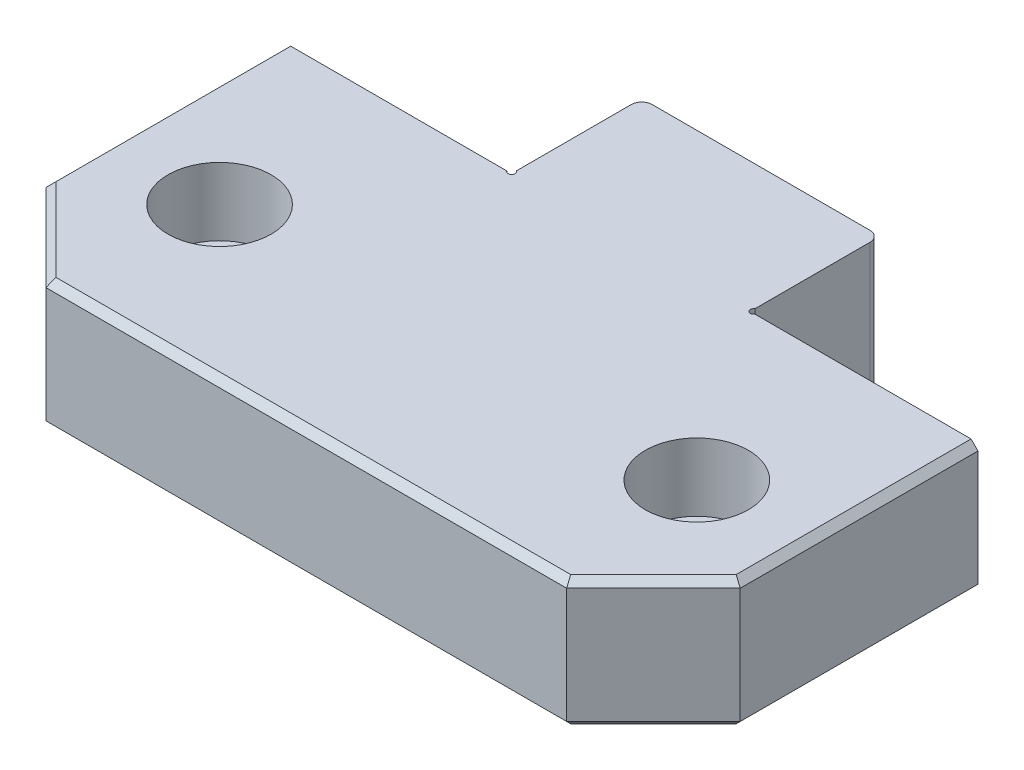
SolidWorks part; units mm, degrees
ref_plane "Front Plane" through (0, 0, 0) normal (0, 0, 1) x (1, 0, 0)
ref_plane "Top Plane" through (0, 0, 0) normal (0, 1, 0) x (1, 0, 0)
ref_plane "Right Plane" through (0, 0, 0) normal (1, 0, 0) x (0, 0, -1)
sketch "Sketch2" plane through (0, 0, 0) normal (0, 1, 0) x (1, 0, 0)
  line L0 (-17.4625, 0.6939) -> (-17.4625, 19.05)
  line L1 (-50.8, -47.498) -> (50.8, -47.498)
  line L2 (-50.8, -47.498) -> (-50.8, 0)
  line L3 (-50.8, 0) -> (-18.1564, 0)
  line L4 (50.8, -47.498) -> (50.8, 0)
  line L5 (-17.4625, 19.05) -> (17.4625, 19.05)
  line L6 (17.4625, 19.05) -> (17.4625, 0.6862)
  line L7 (18.1487, 0) -> (50.8, 0)
  line L8 (0, -55) -> (0, 55) construction
  line L10 (-55, 0) -> (55, 0) construction
  arc A0 (17.4625, 0.6862) -> (18.1487, 0) centre (17.7165, 0.254) ccw
  arc A2 (-18.1564, 0) -> (-17.4625, 0.6939) centre (-17.7165, 0.254) ccw
  dimension "D8" = 1.0026
  dimension "D9" = 0.254
  dimension "D12" = 1.016
  dimension "D1" = 101.6
  dimension "D2" = 0.254
  dimension "D3" = 50.8
  dimension "D4" = 47.498
  dimension "D5" = 19.05
  dimension "D6" = 17.4625
  dimension "D7" = 34.925
  dimension "D10" = 0.254
  dimension "D11" = 0.254
extrude "Extrude1" add sketch "Sketch2" along normal blind 18.923
chamfer "Chamfer1" distance 12.7 angle 45 2 edges at (50.8, 9.4615, 47.498) (-50.8, 9.4615, 47.498)
sketch "Sketch4" plane through (0, 0, 0) normal (0, -1, 0) x (1, 0, 0)
  line L5 (-38.1, 47.498) -> (38.1, 47.498) construction
  line L6 (-50.8, 0) -> (-50.8, 34.798) construction
  line L7 (50.8, 34.798) -> (50.8, 0) construction
  circle A0 centre (34.925, 25.273) radius 5.1562
  circle A1 centre (-34.925, 25.273) radius 5.1562
  dimension "D5" = 10.3124
  dimension "D6" = 10.3124
  dimension "D1" = 22.225
  dimension "D2" = 15.875
  dimension "D3" = 15.875
  dimension "D4" = 22.225
extrude "Cut-Extrude2" cut sketch "Sketch4" against normal blind 15.748
sketch "Sketch5" plane through (0, 0, 0) normal (0, -1, 0) x (1, 0, 0)
  circle A1 centre (34.925, 25.273) radius 7.5438
  circle A3 centre (-34.925, 25.273) radius 7.5438
  dimension "D1" = 15.0876
  dimension "D2" = 15.0876
extrude "Cut-Extrude3" cut sketch "Sketch5" along normal blind 9.9314 from surface at -18.923
fillet "Fillet2" radius 1.524 2 edges at (-17.4625, 9.4615, -19.05) (17.4625, 9.4615, -19.05)
chamfer "Chamfer3" distance 1.016 angle 45 10 edges at (-50.8, 18.923, 17.399) (-44.45, 18.923, 41.148) (50.8, 18.923, 17.399) (44.45, 18.923, 41.148) (0, 18.923, 47.498) (-50.8, 0, 17.399) (-44.45, 0, 41.148) (0, 0, 47.498) (44.45, 0, 41.148) (50.8, 0, 17.399)
sketch "Sketch6" plane through (0, 0, 0) normal (0, -1, 0) x (1, 0, 0)
  line L0 (15.9385, -19.05) -> (-15.9385, -19.05) construction
  line L1 (17.4625, -19.05) -> (-17.4625, -19.05)
  line L2 (-17.4625, -17.526) -> (-17.4625, -0.6939) construction
  line L3 (-17.4625, -19.05) -> (-17.4625, 0)
  line L4 (17.4625, -0.6862) -> (17.4625, -17.526) construction
  line L5 (17.4625, 0) -> (17.4625, -19.05)
  line L6 (-18.1564, 0) -> (-49.784, 0) construction
  line L7 (17.4625, 0) -> (-17.4625, 0)
extrude "Extrude2" cut sketch "Sketch6" against normal blind 0.254
